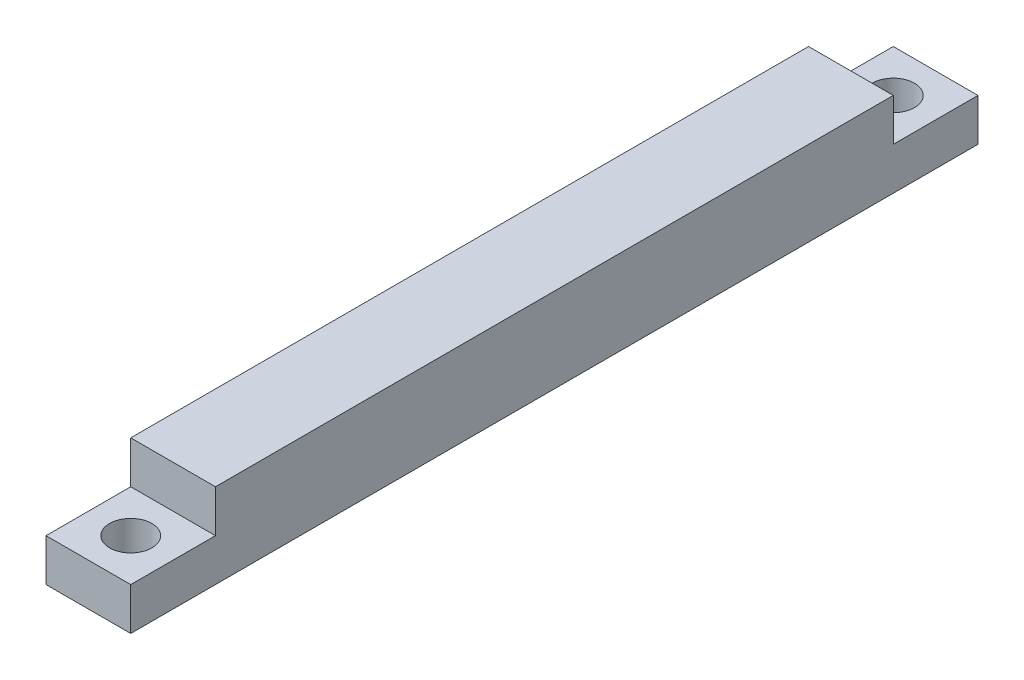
SolidWorks part; units mm, degrees
ref_plane "Plan de face" through (0, 0, 0) normal (0, 0, 1) x (1, 0, 0)
ref_plane "Plan de dessus" through (0, 0, 0) normal (0, 1, 0) x (1, 0, 0)
ref_plane "Plan de droite" through (0, 0, 0) normal (1, 0, 0) x (0, 0, -1)
sketch "Esquisse1" plane through (0, 0, 0) normal (0, 0, 1) x (1, 0, 0)
  line L1 (0, 0) -> (-10, 0)
  line L2 (0, 0) -> (0, 10)
  line L3 (0, 10) -> (-10, 10)
  line L4 (-10, 0) -> (-10, 10)
  dimension "D1" = 10
  dimension "D2" = 10
extrude "Boss.-Extru.1" add sketch "Esquisse1" along normal blind 80
sketch "Esquisse4" plane through (0, 0, 0) normal (1, 0, 0) x (0, 0, -1)
  line L0 (-80, 0) -> (-80, 10) construction
  line L1 (-80, 5) -> (-90, 5)
  line L2 (-80, 5) -> (-80, 0)
  line L3 (-80, 0) -> (-90, 0)
  line L4 (-90, 5) -> (-90, 0)
  line L5 (-80, 0) -> (0, 0) construction
  line L6 (0, 0) -> (10, 0)
  line L7 (0, 0) -> (0, 5)
  line L8 (0, 5) -> (10, 5)
  line L9 (10, 0) -> (10, 5)
  line L10 (0, 0) -> (0, 10) construction
  dimension "D1" = 10
  dimension "D2" = 5
  dimension "D3" = 5
  dimension "D4" = 10
extrude "Boss.-Extru.2" add sketch "Esquisse4" against normal up to surface (10 mm away)
sketch "Esquisse5" plane through (0, 5, 0) normal (0, 1, 0) x (1, 0, 0)
  line L0 (-10, -90) -> (0, -90) construction
  line L1 (0, -80) -> (0, -90) construction
  line L2 (-10, 10) -> (0, 10) construction
  line L3 (0, 10) -> (0, 0) construction
  circle A0 centre (-5, -85) radius 2.5
  circle A1 centre (-5, 5) radius 2.5
  point P8 (-5, 10)
  dimension "D2" = 5
  dimension "D3" = 5
  dimension "D4" = 5
  dimension "D5" = 5
  dimension "D1" = 5
extrude "Enlèv. mat.-Extru.2" cut sketch "Esquisse5" against normal through all
